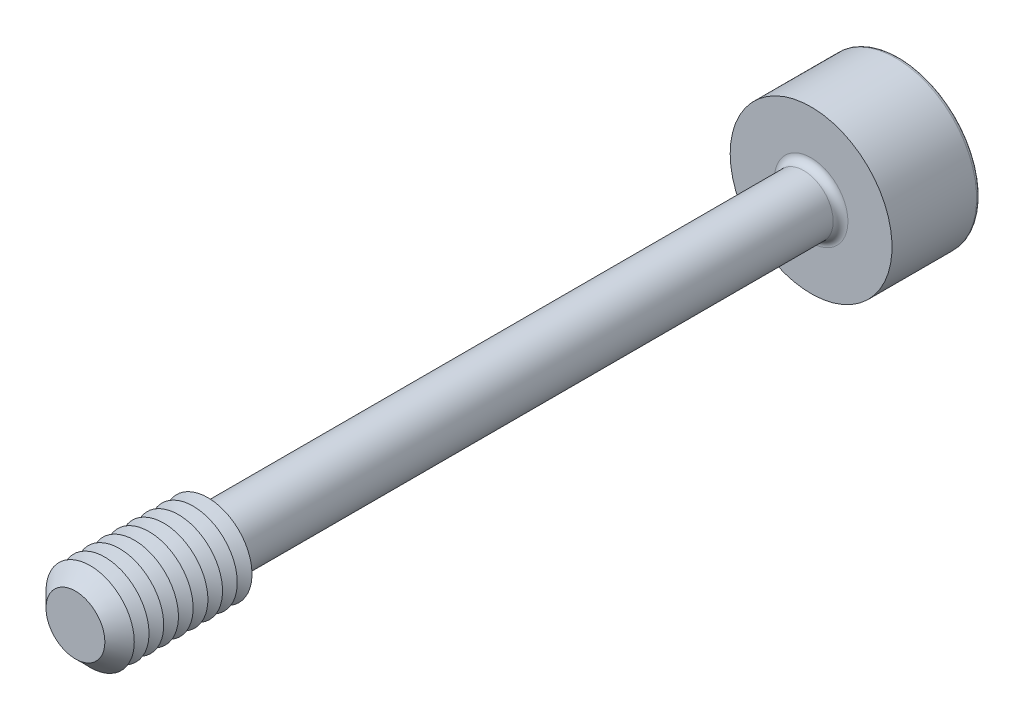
SolidWorks part; units mm, degrees
ref_plane "Front Plane" through (0, 0, 0) normal (0, 0, 1) x (1, 0, 0)
ref_plane "Top Plane" through (0, 0, 0) normal (0, 1, 0) x (1, 0, 0)
ref_plane "Right Plane" through (0, 0, 0) normal (1, 0, 0) x (0, 0, -1)
sketch "Sketch1" plane through (0, 0, 0) normal (0, 0, 1) x (1, 0, 0)
  circle A0 centre (0, 0) radius 1
  dimension "D1" = 2
extrude "Extrude1" add sketch "Sketch1" along normal mid plane 25
sketch "Sketch2" plane through (0, 0, 0) normal (1, 0, 0) x (0, 0, -1)
  line L0 (-12.5, 0) -> (-12.5, 1.5)
  line L1 (-12.5, 1) -> (-12.5, -1) construction
  line L2 (-12.5, 1.5) -> (-8, 1.5)
  line L3 (-8, 1.5) -> (-7.7113, 1)
  line L4 (12.5, 1) -> (-12.5, 1) construction
  line L5 (-7.7113, 1) -> (-7.7113, 0)
  line L6 (-7.7113, 0) -> (-12.5, 0)
  dimension "D1" = 1.5
  dimension "D2" = 120
  dimension "D3" = 4.5
revolve "Revolve1" add sketch "Sketch2" angle 360 about L6
chamfer "Chamfer1" distance 0.5 angle 45 1 edges at (0, 1.5, 12.5)
sketch "Sketch3" plane through (0, 0, -12.5) normal (0, 0, -1) x (-1, 0, 0)
  circle A0 centre (0, 0) radius 2.75
  dimension "D1" = 5.5
extrude "Extrude2" add sketch "Sketch3" along normal blind 3
sketch "Sketch4" plane through (-13.7, 0, -15.5) normal (0, 0, 1) x (1, 0, 0)
  line L2 (12.9783, -1.25) -> (14.4217, -1.25)
  line L3 (14.4217, -1.25) -> (15.1434, 0)
  line L4 (15.1434, 0) -> (14.4217, 1.25)
  line L6 (14.4217, 1.25) -> (12.9783, 1.25)
  line L7 (12.9783, 1.25) -> (12.2566, 0)
  line L8 (12.2566, 0) -> (12.9783, -1.25)
  circle A0 centre (13.7, 0) radius 1.25 construction
  dimension "D1" = 2.5
extrude "Extrude3" cut sketch "Sketch4" along normal blind 2.5
fillet "Fillet1" radius 0.25 1 edges at (-1, 0, -12.5)
fillet "Fillet2" radius 0.125 1 edges at (-2.75, 0, -15.5)
sketch "Sketch5" plane through (0, 0, 0) normal (1, 0, 0) x (0, 0, -1)
  line L0 (13, 0) -> (13, -1.25)
  line L1 (13, -1.25) -> (12.2783, 0)
  line L2 (12.2783, 0) -> (13, 0)
  dimension "D1" = 30
revolve "Cut-Revolve1" cut sketch "Sketch5" angle 360 about L2
sketch "Sketch6" plane through (0, 0, 0) normal (1, 0, 0) x (0, 0, -1)
  line L0 (1.332, 0) -> (-13.289, 0) construction
sketch "Sketch7" plane through (0, 0, 0) normal (1, 0, 0) x (0, 0, -1)
  line L0 (-8, 1.5) -> (-8.25, 1.067)
  line L1 (-8.25, 1.067) -> (-8.5, 1.5)
  line L2 (-8, 1.5) -> (-12, 1.5) construction
  line L3 (-8.5, 1.5) -> (-8, 1.5)
  dimension "D1" = 0.5
revolve "Cut-Revolve2" cut sketch "Sketch7" angle 360 about L0
pattern_linear "LPattern1" count 8 spacing 0.5 along (0, 0, 1) of "Cut-Revolve2"
